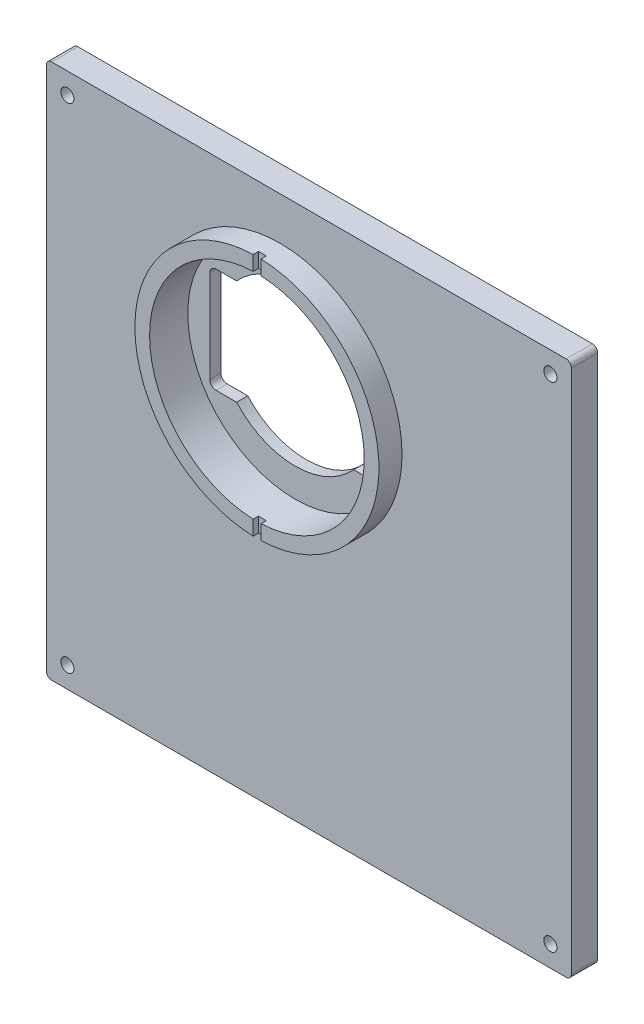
SolidWorks part; units mm, degrees
ref_plane "front" through (0, 0, 0) normal (0, 0, 1) x (1, 0, 0)
ref_plane "top" through (0, 0, 0) normal (0, 1, 0) x (1, 0, 0)
ref_plane "right" through (0, 0, 0) normal (1, 0, 0) x (0, 0, -1)
sketch "Sketch1" plane through (0, 0, 0) normal (0, 0, 1) x (1, 0, 0)
  line L0 (-56.515, 38.608) -> (-56.515, -88.392)
  line L1 (-55.245, -89.662) -> (69.215, -89.662)
  line L2 (70.485, -88.392) -> (70.485, 38.608)
  line L3 (69.215, 39.878) -> (-55.245, 39.878)
  arc A0 (-55.245, 39.878) -> (-56.515, 38.608) centre (-55.245, 38.608) ccw
  arc A1 (70.485, 38.608) -> (69.215, 39.878) centre (69.215, 38.608) ccw
  arc A2 (69.215, -89.662) -> (70.485, -88.392) centre (69.215, -88.392) ccw
  arc A3 (-56.515, -88.392) -> (-55.245, -89.662) centre (-55.245, -88.392) ccw
  point P9 (70.485, 39.878)
  point P12 (70.485, -89.662)
  point P15 (-56.515, -89.662)
  dimension "D4" = 1.27
  dimension "D1" = 127
  dimension "D2" = 129.54
  dimension "D3" = 56.515
  dimension "D5" = 39.878
extrude "Base-Extrude" add sketch "Sketch1" along normal blind 6.35
sketch "BOSS OD" plane through (0, 0, 6.35) normal (0, 0, 1) x (1, 0, 0)
  circle A0 centre (0, 0) radius 29.5148
  dimension "D1" = 59.0296
extrude "Boss-Extrude3" add sketch "BOSS OD" along normal blind 5.588
sketch "Sketch5" plane through (0, 0, 11.938) normal (0, 0, 1) x (1, 0, 0)
  circle A0 centre (0, 0) radius 25.9588
  dimension "D1" = 51.9176
extrude "Cut-Extrude1" cut sketch "Sketch5" against normal blind 9.2456
sketch "Sketch6" plane through (0, 0, 2.6924) normal (0, 0, 1) x (1, 0, 0)
  line L0 (0, 45.5842) -> (0, -94.4574) construction
  circle A0 centre (0, 0) radius 19.0119
  dimension "D1" = 38.0238
extrude "Cut-Extrude2" cut sketch "Sketch6" against normal through all
sketch "Sketch9" plane through (0, 0, 2.6924) normal (0, 0, 1) x (1, 0, 0)
  line L0 (-19.1262, -12.7) -> (19.1008, -12.7)
  line L1 (20.6248, -11.176) -> (20.6248, 11.176)
  line L2 (19.1008, 12.7) -> (-19.1262, 12.7)
  line L3 (-20.6502, 11.176) -> (-20.6502, -11.176)
  arc A1 (-20.6502, 11.176) -> (-19.1262, 12.7) centre (-19.1262, 11.176) cw
  arc A2 (-19.1262, -12.7) -> (-20.6502, -11.176) centre (-19.1262, -11.176) cw
  arc A3 (20.6248, -11.176) -> (19.1008, -12.7) centre (19.1008, -11.176) cw
  arc A4 (19.1008, 12.7) -> (20.6248, 11.176) centre (19.1008, 11.176) cw
  point P3 (-20.6502, 12.7)
  point P12 (20.6248, -12.7)
  point P15 (20.6248, 12.7)
  dimension "D5" = 1.524
  dimension "D1" = 25.4
  dimension "D2" = 41.275
  dimension "D3" = 20.6248
  dimension "D4" = 12.7
extrude "Cut-Extrude3" cut sketch "Sketch9" against normal through all
ref_plane "Plane4" through (0, 0, 11.938) normal (0, 0, 1) x (1, 0, 0)
sketch "Sketch10" plane through (0, 0, 11.938) normal (0, 0, 1) x (1, 0, 0)
  line L0 (-0.889, 35.3373) -> (-0.889, -34.1142)
  line L1 (-0.889, -34.1142) -> (1.016, -34.1142)
  line L2 (1.016, -34.1142) -> (1.016, 35.3373)
  line L3 (1.016, 35.3373) -> (-0.889, 35.3373)
  dimension "D1" = 69.4515
  dimension "D2" = 1.905
  dimension "D3" = 0.889
  dimension "D4" = 34.1142
extrude "Cut-Extrude5" cut sketch "Sketch10" against normal blind 1.27
sketch "Sketch15" plane through (0, 0, 6.35) normal (0, 0, 1) x (1, 0, 0)
  line L1 (70.485, -88.392) -> (70.485, 38.608) construction
  line L2 (-55.245, -89.662) -> (69.215, -89.662) construction
  circle A0 centre (65.405, -84.582) radius 1.5875
  dimension "D1" = 3.175
  dimension "D2" = 5.08
  dimension "D3" = 5.08
extrude "Cut-Extrude7" cut sketch "Sketch15" against normal through all
sketch "Sketch17" plane through (0, 0, 6.35) normal (0, 0, 1) x (1, 0, 0)
  line L0 (-55.245, -89.662) -> (69.215, -89.662) construction
  line L1 (-56.515, 38.608) -> (-56.515, -88.392) construction
  line L2 (69.215, 39.878) -> (-55.245, 39.878) construction
  line L3 (70.485, -88.392) -> (70.485, 38.608) construction
  circle A0 centre (-51.435, -84.582) radius 1.5875
  circle A1 centre (-51.435, 34.798) radius 1.5875
  circle A2 centre (65.405, 34.798) radius 1.5875
  dimension "D1" = 3.175
  dimension "D4" = 3.175
  dimension "D7" = 3.175
  dimension "D2" = 5.08
  dimension "D3" = 5.08
  dimension "D5" = 5.08
  dimension "D6" = 5.08
  dimension "D8" = 5.08
  dimension "D9" = 5.08
extrude "Cut-Extrude8" cut sketch "Sketch17" against normal through all
